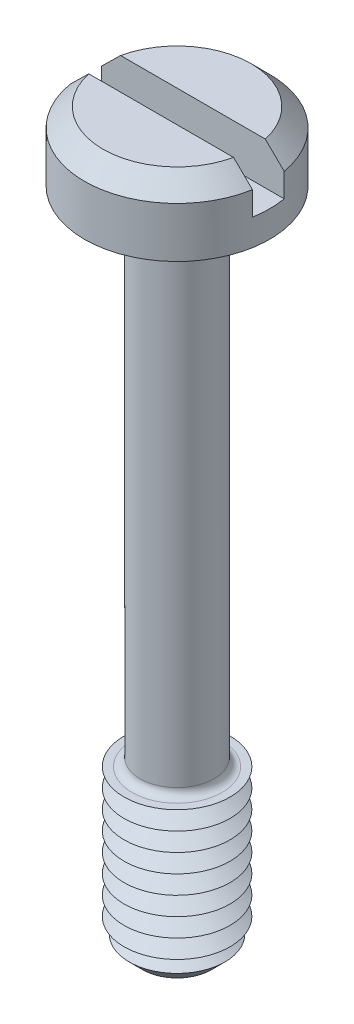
SolidWorks part; units mm, degrees
ref_plane "Front Plane" through (0, 0, 0) normal (0, 0, 1) x (1, 0, 0)
ref_plane "Top Plane" through (0, 0, 0) normal (0, 1, 0) x (1, 0, 0)
ref_plane "Right Plane" through (0, 0, 0) normal (1, 0, 0) x (0, 0, -1)
sketch "Sketch1" plane through (0, 0, 0) normal (0, 1, 0) x (1, 0, 0)
  circle A0 centre (0, 0) radius 3.5
  dimension "D1" = 7
extrude "Boss-Extrude1" add sketch "Sketch1" along normal blind 2.6
sketch "Sketch2" plane through (0, 0, 0) normal (0, -1, 0) x (1, 0, 0)
  circle A0 centre (0, 0) radius 1.4
  dimension "D1" = 2.8
extrude "Boss-Extrude2" add sketch "Sketch2" along normal blind 25
sketch "Sketch3" plane through (0, -25, 0) normal (0, -1, 0) x (1, 0, 0)
  circle A0 centre (0, 0) radius 2
  dimension "D1" = 4
extrude "Boss-Extrude3" add sketch "Sketch3" against normal blind 6
chamfer "Chamfer1" distance 0.7 angle 45 1 edges at (0, -25, -2)
sketch "Sketch4" plane through (0, 0, 0) normal (1, 0, 0) x (0, 0, -1)
  line L0 (0, -6.5871) -> (0, -12.0372) construction
sketch "Sketch5" plane through (0, 0, 0) normal (1, 0, 0) x (0, 0, -1)
  line L0 (-2, -19) -> (-1.3938, -19.35)
  line L1 (-1.3938, -19.35) -> (-2, -19.7)
  line L2 (-2, -19) -> (-2, -24.3) construction
  line L3 (-2, -19.7) -> (-2, -19)
  dimension "D1" = 0.7
revolve "Cut-Revolve1" cut sketch "Sketch5" angle 360 about L0
pattern_linear "LPattern1" count 8 spacing 0.7 along (0, -1, 0) of "Cut-Revolve1"
fillet "Fillet1" radius 0.3 2 edges at (0, -19, -1.4) (0, 0, -1.4)
chamfer "Chamfer2" distance 0.7 angle 45 1 edges at (0, 2.6, 3.5)
sketch "Sketch6" plane through (0, 2.6, 0) normal (0, 1, 0) x (1, 0, 0)
  line L1 (3.5, -0.6) -> (-3.5, -0.6)
  line L2 (3.5, -0.6) -> (3.5, 0.6)
  line L3 (3.5, 0.6) -> (-3.5, 0.6)
  line L4 (-3.5, -0.6) -> (-3.5, 0.6)
  line L5 (3.5, -0.6) -> (-3.5, 0.6) construction
  line L6 (3.5, 0.6) -> (-3.5, -0.6) construction
  circle A0 centre (0, 0) radius 3.5 construction
  point P0 (0, 0)
  dimension "D1" = 1.2
extrude "Cut-Extrude1" cut sketch "Sketch6" against normal blind 1.6
